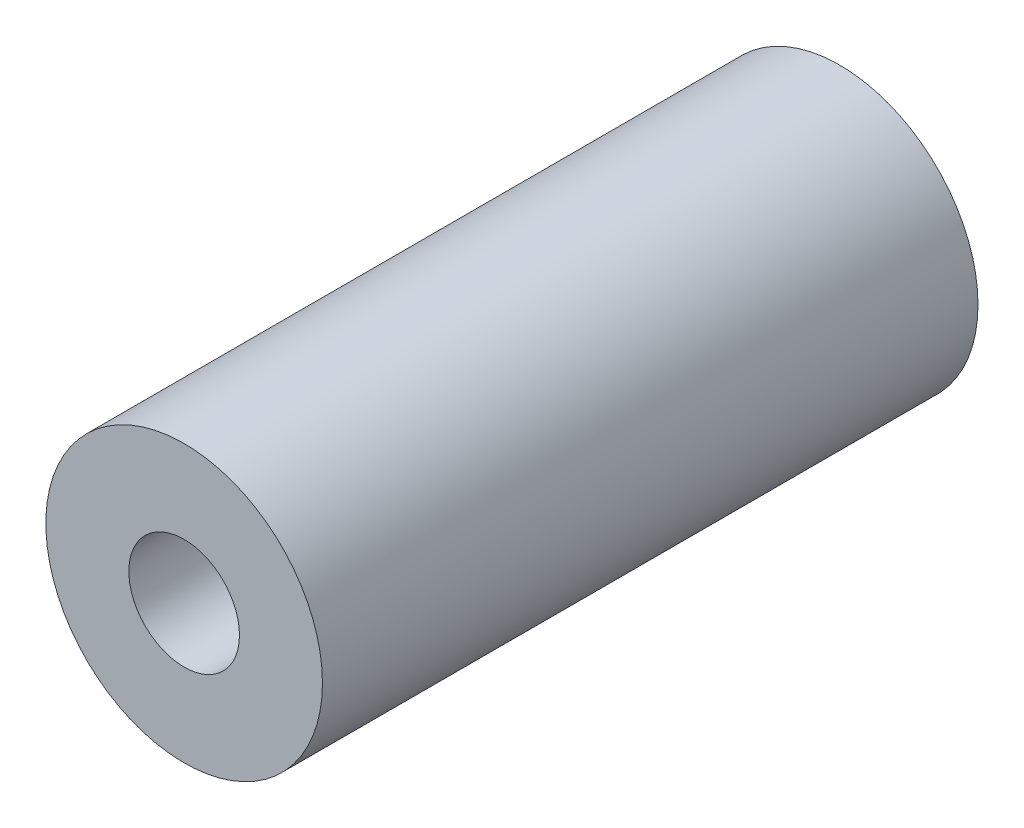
SolidWorks part; units mm, degrees
ref_plane "Ebene vorne" through (0, 0, 0) normal (0, 0, 1) x (1, 0, 0)
ref_plane "Ebene oben" through (0, 0, 0) normal (0, 1, 0) x (1, 0, 0)
ref_plane "Ebene rechts" through (0, 0, 0) normal (1, 0, 0) x (0, 0, -1)
sketch "Skizze1" plane through (0, 0, 0) normal (0, 0, 1) x (1, 0, 0)
  circle A0 centre (0, 0) radius 10
  circle A1 centre (0, 0) radius 25
  dimension "D1" = 20
  dimension "D2" = 50
extrude "Linear austragen1" add sketch "Skizze1" along normal blind 118.5
equation "\"LÄNGE\"=0"
equation "\"BREITE\"=0"
equation "\"HÖHE\"=0"
equation "\"DURCHMESSER\"=0"
equation "\"Stückzahl\"= 1"
